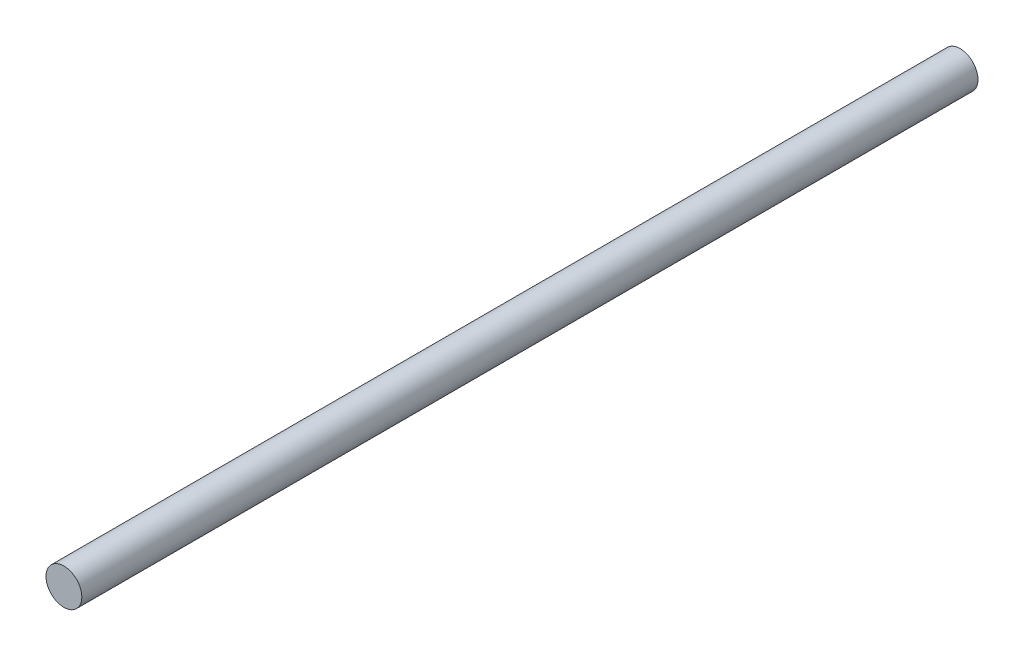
SolidWorks part; units mm, degrees
ref_plane "Front Plane" through (0, 0, 0) normal (0, 0, 1) x (1, 0, 0)
ref_plane "Top Plane" through (0, 0, 0) normal (0, 1, 0) x (1, 0, 0)
ref_plane "Right Plane" through (0, 0, 0) normal (1, 0, 0) x (0, 0, -1)
sketch "Sketch1" plane through (0, 0, 0) normal (0, 0, 1) x (1, 0, 0)
  circle A0 centre (0, 0) radius 30
  dimension "D1" = 60
extrude "Boss-Extrude1" add sketch "Sketch1" against normal blind 1500
